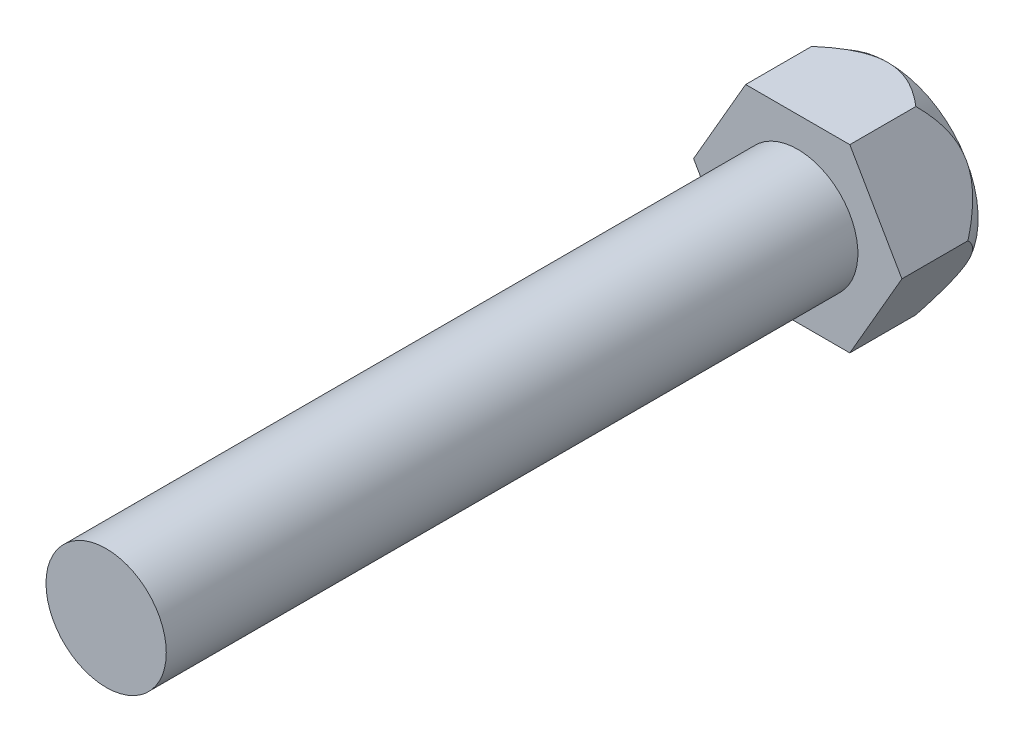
SolidWorks part; units mm, degrees
ref_plane "Front Plane" through (0, 0, 0) normal (0, 0, 1) x (1, 0, 0)
ref_plane "Top Plane" through (0, 0, 0) normal (0, 1, 0) x (1, 0, 0)
ref_plane "Right Plane" through (0, 0, 0) normal (1, 0, 0) x (0, 0, -1)
sketch "Sketch1" plane through (0, 0, 0) normal (0, 0, 1) x (1, 0, 0)
  circle A0 centre (0, 0) radius 10
  dimension "D1" = 20
extrude "Boss-Extrude1" add sketch "Sketch1" along normal mid plane 115
sketch "Sketch2" plane through (0, 0, -57.5) normal (0, 0, -1) x (-1, 0, 0)
  line L1 (17.3205, 0) -> (8.6603, 15)
  line L2 (8.6603, 15) -> (-8.6603, 15)
  line L3 (-8.6603, 15) -> (-17.3205, 0)
  line L4 (-17.3205, 0) -> (-8.6603, -15)
  line L5 (-8.6603, -15) -> (8.6603, -15)
  line L6 (8.6603, -15) -> (17.3205, 0)
  circle A0 centre (0, 0) radius 15 construction
  dimension "D1" = 30
extrude "Boss-Extrude2" add sketch "Sketch2" along normal blind 15
ref_plane "Plane1" through (0, 0, 0) normal (-0.866, 0.5, 0) x (0, 0, 1)
sketch "Sketch3" plane through (0, 0, 0) normal (-0.866, 0.5, 0) x (0, 0, 1)
  line L0 (65.4416, 0) -> (-98.563, 0) construction
  line L1 (-72.5, 15) -> (-72.5, 17.3205)
  line L2 (-72.5, 17.3205) -> (-72.5, 8.6603) construction
  line L3 (-72.5, 17.3205) -> (-68.4808, 17.3205)
  line L4 (-72.5, 15) -> (-68.4808, 17.3205)
  line L6 (-72.5, 17.3205) -> (-57.5, 17.3205) construction
  dimension "D2" = 60
  dimension "D1" = 30
revolve "Cut-Revolve1" cut sketch "Sketch3" angle 360 about L0
